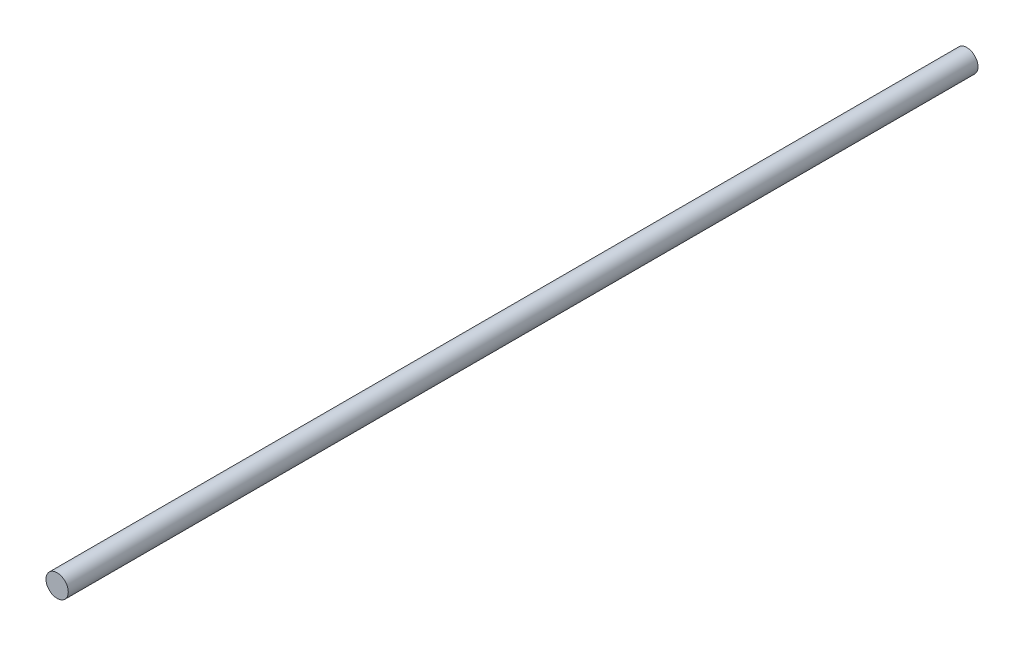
SolidWorks part; units mm, degrees
ref_plane "Front Plane" through (0, 0, 0) normal (0, 0, 1) x (1, 0, 0)
ref_plane "Top Plane" through (0, 0, 0) normal (0, 1, 0) x (1, 0, 0)
ref_plane "Right Plane" through (0, 0, 0) normal (1, 0, 0) x (0, 0, -1)
sketch "Sketch1" plane through (0, 0, 0) normal (0, 0, 1) x (1, 0, 0)
  circle A1 centre (80, 15) radius 4.9
  dimension "D2" = 9.8
extrude "Boss-Extrude1" add sketch "Sketch1" along normal blind 200 and the other way blind 200
